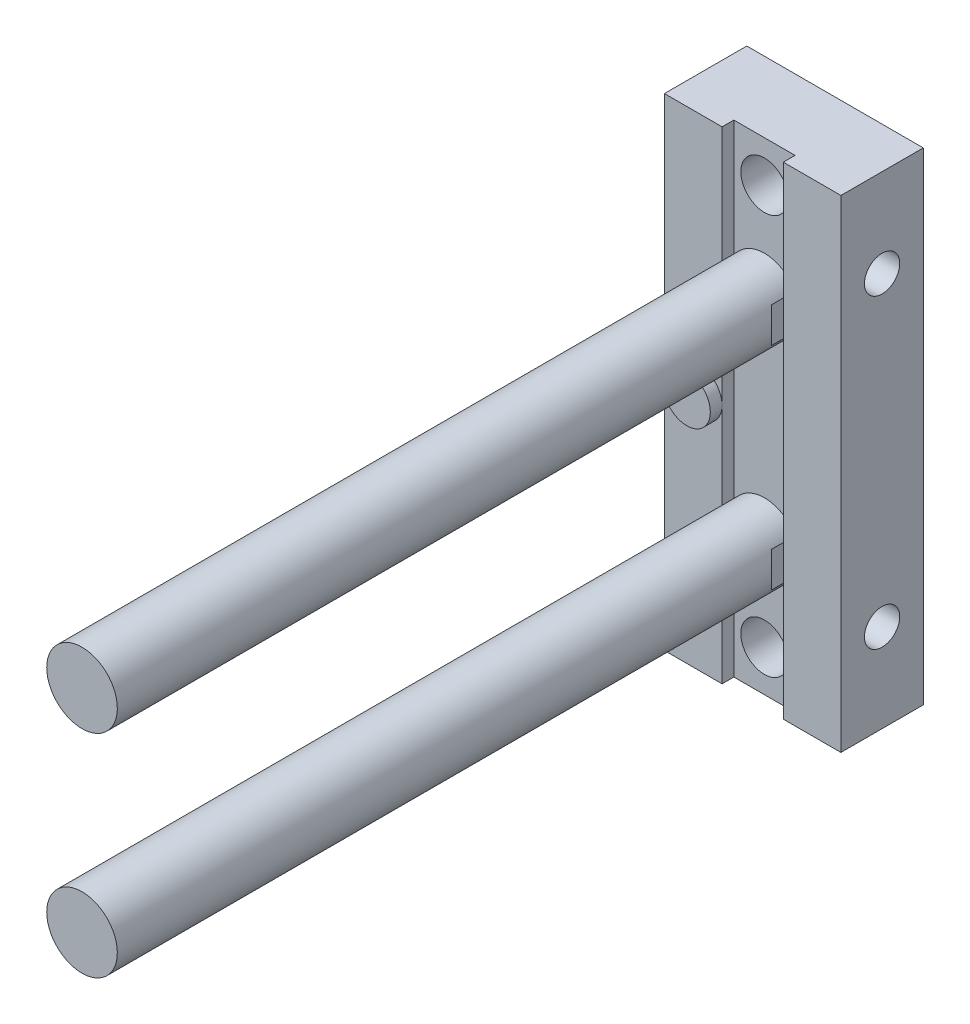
SolidWorks part; units mm, degrees
ref_plane "前视基准面" through (0, 0, 0) normal (0, 0, 1) x (1, 0, 0)
ref_plane "上视基准面" through (0, 0, 0) normal (0, 1, 0) x (1, 0, 0)
ref_plane "右视基准面" through (0, 0, 0) normal (1, 0, 0) x (0, 0, -1)
imported_body "输入1"
imported_body "输入2"
imported_body "输入3"
sketch "草图1" plane through (8.5, 0, 0) normal (1, 0, 0) x (0, 0, -1)
  line L0 (-160, -21) -> (-64, -21) construction
  line L1 (-166.9553, 40.1266) -> (-64, 40.1266)
  line L2 (-166.9553, 40.1266) -> (-166.9553, -21)
  line L3 (-166.9553, -21) -> (-64, -21)
  line L4 (-64, 40.1266) -> (-64, -21)
extrude "切除-拉伸1" cut sketch "草图1" against normal through all
sketch "草图2" plane through (0, 0, 64) normal (0, 0, 1) x (1, 0, 0)
  circle A0 centre (-4.6246, -0.2757) radius 4.1305
extrude "切除-拉伸2" cut sketch "草图2" against normal blind 10
